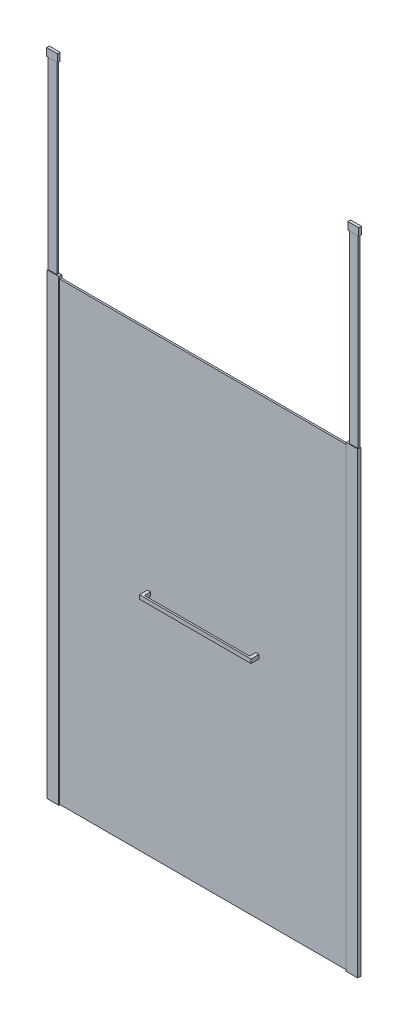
SolidWorks part; units mm, degrees
ref_plane "Płaszczyzna przednia" through (0, 0, 0) normal (0, 0, 1) x (1, 0, 0)
ref_plane "Płaszczyzna górna" through (0, 0, 0) normal (0, 1, 0) x (1, 0, 0)
ref_plane "Płaszczyzna prawa" through (0, 0, 0) normal (1, 0, 0) x (0, 0, -1)
sketch "Szkic1" plane through (0, 0, 0) normal (0, 1, 0) x (1, 0, 0)
  line L0 (0, 0) -> (0, 14)
  line L1 (0, 14) -> (53, 14)
  line L2 (53, 14) -> (53, 11)
  line L3 (53, 11) -> (42.9, 11)
  line L4 (42.9, 11) -> (42.9, 3)
  line L5 (42.9, 3) -> (53, 3)
  line L6 (53, 3) -> (53, 0)
  line L7 (53, 0) -> (0, 0)
  dimension "D1" = 53
  dimension "D2" = 14
  dimension "D3" = 10.1
  dimension "D4" = 3
  dimension "D5" = 8
extrude "Dodanie-wyciągnięcie1" add sketch "Szkic1" along normal blind 2100 from offset 3
sketch "Szkic2" plane through (0, 3, 0) normal (0, -1, 0) x (1, 0, 0)
  line L0 (42.9, -11) -> (53, -11) construction
  line L1 (42.9, -3) -> (1389.9, -3)
  line L2 (42.9, -3) -> (42.9, -11)
  line L3 (42.9, -11) -> (1389.9, -11)
  line L4 (1389.9, -3) -> (1389.9, -11)
  dimension "D1" = 1347
extrude "Dodanie-wyciągnięcie2" add sketch "Szkic2" against normal blind 2100 separate body
sketch "Szkic3" plane through (0, 3, 0) normal (0, -1, 0) x (1, 0, 0)
  line L0 (1379.8, -3) -> (1379.8, 0)
  line L1 (1389.9, -3) -> (42.9, -3) construction
  line L2 (1379.8, 0) -> (1432.8, 0)
  line L3 (1432.8, 0) -> (1432.8, -14)
  line L4 (1432.8, -14) -> (1379.8, -14)
  line L5 (1379.8, -14) -> (1379.8, -11)
  line L6 (1379.8, -11) -> (1389.9, -11)
  line L7 (1389.9, -11) -> (1389.9, -3)
  line L8 (1389.9, -3) -> (1379.8, -3)
  line L9 (42.9, -11) -> (1389.9, -11) construction
  line L10 (1389.9, -11) -> (1389.9, -3) construction
  dimension "D1" = 10.1
  dimension "D2" = 3
  dimension "D3" = 3
  dimension "D4" = 53
extrude "Dodanie-wyciągnięcie3" add sketch "Szkic3" against normal blind 2108 separate body
sketch "Szkic4" plane through (0, 2103, 0) normal (0, 1, 0) x (1, 0, 0)
  line L1 (0, 14) -> (53, 14)
  line L2 (0, 14) -> (0, 0)
  line L3 (0, 0) -> (53, 0)
  line L4 (53, 14) -> (53, 0)
extrude "Dodanie-wyciągnięcie4" add sketch "Szkic4" along normal blind 11
sketch "Szkic5" plane through (0, 2111, 0) normal (0, 1, 0) x (1, 0, 0)
  line L1 (1432.8, 14) -> (1379.8, 14)
  line L2 (1432.8, 14) -> (1432.8, 0)
  line L3 (1432.8, 0) -> (1379.8, 0)
  line L4 (1379.8, 14) -> (1379.8, 0)
extrude "Dodanie-wyciągnięcie5" add sketch "Szkic5" along normal blind 3
sketch "Szkic6" plane through (1379.8, 0, 0) normal (-1, 0, 0) x (0, 0, 1)
  line L0 (-11, 2111) -> (-3, 2111) construction
  line L1 (-2.95, 2111) -> (-11.05, 2111)
  line L2 (-2.95, 2111) -> (-2.95, 2103.2)
  line L3 (-2.95, 2103.2) -> (-11.05, 2103.2)
  line L4 (-11.05, 2111) -> (-11.05, 2103.2)
  point P6 (-7, 2111)
  dimension "D1" = 8.1
  dimension "D2" = 7.8
extrude "Dodanie-wyciągnięcie6" add sketch "Szkic6" against normal blind 15
sketch "Szkic7" plane through (0, 3, 0) normal (0, -1, 0) x (1, 0, 0)
  line L1 (1379.8, 0) -> (1432.8, 0)
  line L2 (1379.8, 0) -> (1379.8, -14)
  line L3 (1379.8, -14) -> (1432.8, -14)
  line L4 (1432.8, 0) -> (1432.8, -14)
extrude "Dodanie-wyciągnięcie7" add sketch "Szkic7" along normal blind 3
sketch "Szkic8" plane through (0, 3, 0) normal (0, -1, 0) x (1, 0, 0)
  line L1 (0, 0) -> (53, 0)
  line L2 (0, 0) -> (0, -14)
  line L3 (0, -14) -> (53, -14)
  line L4 (53, 0) -> (53, -14)
extrude "Dodanie-wyciągnięcie8" add sketch "Szkic8" along normal blind 3
sketch "Szkic9" plane through (0, 2114, 2099.6) normal (0, -1, 0) x (-1, 0, 0)
  line L0 (0, 2113.6) -> (0, 2099.6) construction
  line L1 (-1431.3, 2110.6) -> (-1391.3, 2110.6)
  line L2 (-1431.3, 2110.6) -> (-1431.3, 2102.6)
  line L3 (-1431.3, 2102.6) -> (-1391.3, 2102.6)
  line L4 (-1391.3, 2110.6) -> (-1391.3, 2102.6)
  line L5 (-1.5, 2102.6) -> (-41.5, 2102.6)
  line L6 (-1.5, 2102.6) -> (-1.5, 2110.6)
  line L7 (-1379.8, 2113.6) -> (-1432.8, 2113.6) construction
  line L8 (-1432.8, 2113.6) -> (-1432.8, 2099.6) construction
  line L9 (-1.5, 2110.6) -> (-41.5, 2110.6)
  line L10 (-41.5, 2102.6) -> (-41.5, 2110.6)
  line L11 (-53, 2113.6) -> (0, 2113.6) construction
  dimension "D1" = 3
  dimension "D2" = 1.5
  dimension "D3" = 8
  dimension "D4" = 40
  dimension "D5" = 1.5
  dimension "D6" = 40
  dimension "D7" = 3
  dimension "D8" = 8
extrude "Dodanie-wyciągnięcie9" add sketch "Szkic9" against normal blind 883 separate body
sketch "Szkic10" plane through (0, 2997, 0) normal (0, 1, 0) x (-1, 0, 0)
  line L0 (-1391.3, -3) -> (-1391.3, -11) construction
  line L1 (-1436.3, -0.75) -> (-1386.3, -0.75)
  line L2 (-1436.3, -0.75) -> (-1436.3, -13.25)
  line L3 (-1436.3, -13.25) -> (-1386.3, -13.25)
  line L4 (-1386.3, -0.75) -> (-1386.3, -13.25)
  line L5 (-1436.3, -0.75) -> (-1386.3, -13.25) construction
  line L6 (-1436.3, -13.25) -> (-1386.3, -0.75) construction
  line L8 (-1411.3, -7) -> (-1431.3, -7) construction
  line L9 (-1431.3, -11) -> (-1431.3, -3) construction
  line L10 (-21.5, -11) -> (-21.5, -7) construction
  line L11 (3.5, -13.25) -> (-46.5, -13.25)
  line L12 (3.5, -13.25) -> (3.5, -0.75)
  line L13 (3.5, -0.75) -> (-46.5, -0.75)
  line L14 (-46.5, -13.25) -> (-46.5, -0.75)
  line L15 (3.5, -13.25) -> (-46.5, -0.75) construction
  line L16 (3.5, -0.75) -> (-46.5, -13.25) construction
  line L17 (-1.5, -11) -> (-41.5, -11) construction
  line L18 (-21.5, -7) -> (-1.5, -7) construction
  line L19 (-1.5, -3) -> (-1.5, -11) construction
  point P0 (-1411.3, -7)
  point P9 (-21.5, -7)
  dimension "D1" = 12.5
  dimension "D2" = 50
  dimension "D3" = 50
  dimension "D4" = 12.5
  dimension "D5" = 5
extrude "Dodanie-wyciągnięcie10" add sketch "Szkic10" along normal blind 35 from offset 32
ref_plane "Płaszczyzna1" through (1411.3, 0, 0) normal (1, 0, 0) x (0, 0, -1)
sketch "Szkic12" plane through (0, 0, -3) normal (0, 0, 1) x (1, 0, 0)
  line L0 (716.4, 1409.7928) -> (716.4, 762.3594) construction
  line L1 (466.4, 1053) -> (966.4, 1053) construction
  line L2 (42.9, 2103) -> (42.9, 3) construction
  line L3 (1389.9, 2103) -> (1389.9, 3) construction
  line L5 (458.9, 1062) -> (473.9, 1062)
  line L6 (458.9, 1062) -> (458.9, 1044)
  line L7 (458.9, 1044) -> (473.9, 1044)
  line L8 (473.9, 1062) -> (473.9, 1044)
  line L9 (458.9, 1062) -> (473.9, 1044) construction
  line L10 (458.9, 1044) -> (473.9, 1062) construction
  line L11 (958.9, 1062) -> (973.9, 1062)
  line L12 (958.9, 1062) -> (958.9, 1044)
  line L13 (958.9, 1044) -> (973.9, 1044)
  line L14 (973.9, 1062) -> (973.9, 1044)
  line L15 (958.9, 1062) -> (973.9, 1044) construction
  line L16 (958.9, 1044) -> (973.9, 1062) construction
  dimension "D1" = 1053
  dimension "D2" = 500
  dimension "D3" = 15
  dimension "D4" = 18
extrude "Dodanie-wyciągnięcie11" add sketch "Szkic12" along normal blind 36.5 and the other way blind 18 separate body
sketch "Szkic13" plane through (473.9, 0, 0) normal (1, 0, 0) x (0, 0, -1)
  line L0 (21, 1044) -> (-33.5, 1044) construction
  line L1 (-33.5, 1062) -> (-25.5, 1062)
  line L2 (-33.5, 1062) -> (-33.5, 1044)
  line L3 (-33.5, 1044) -> (-25.5, 1044)
  line L4 (-25.5, 1062) -> (-25.5, 1044)
  dimension "D1" = 8
extrude "Dodanie-wyciągnięcie12" add sketch "Szkic13" along normal up to surface (485 mm away)
